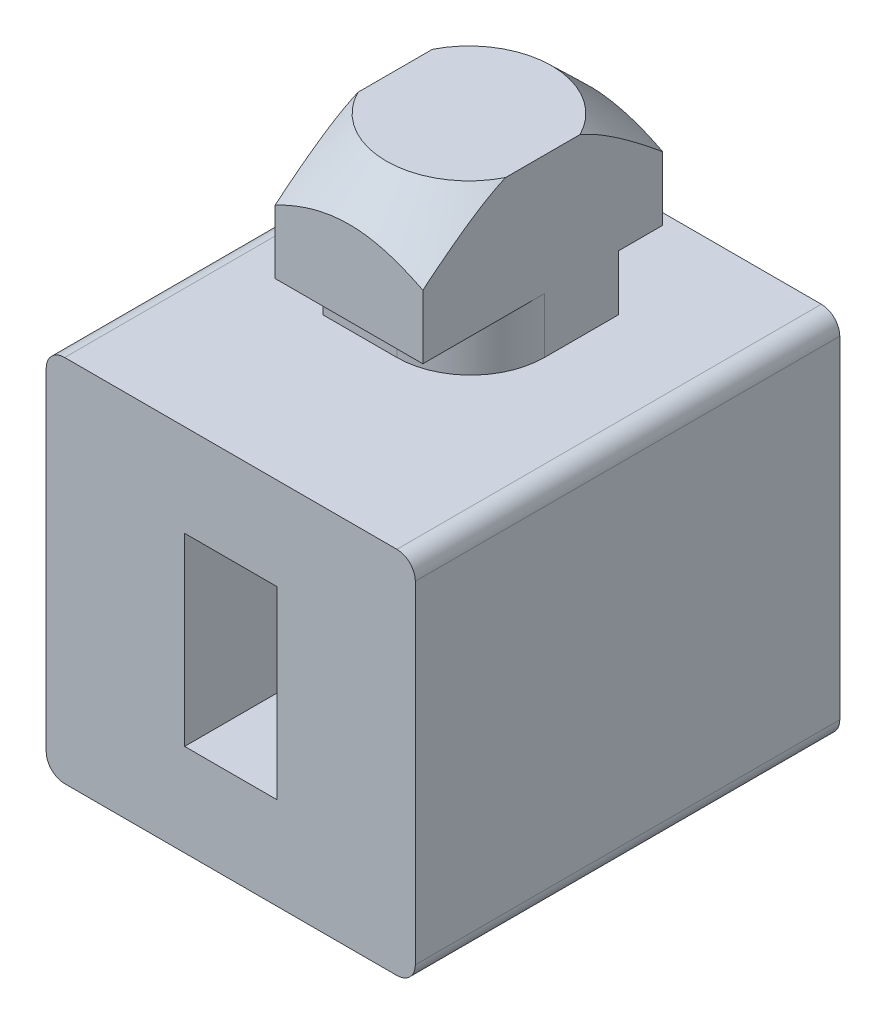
SolidWorks part; units mm, degrees
ref_plane "前视基准面" through (0, 0, 0) normal (0, 0, 1) x (1, 0, 0)
ref_plane "上视基准面" through (0, 0, 0) normal (0, 1, 0) x (1, 0, 0)
ref_plane "右视基准面" through (0, 0, 0) normal (1, 0, 0) x (0, 0, -1)
sketch "草图1" plane through (0, 0, 0) normal (0, 0, 1) x (1, 0, 0)
  line L1 (-10, 10) -> (10, 10)
  line L2 (-10, 10) -> (-10, -10)
  line L3 (-10, -10) -> (10, -10)
  line L4 (10, 10) -> (10, -10)
  line L5 (-10, 10) -> (10, -10) construction
  line L6 (-10, -10) -> (10, 10) construction
  point P0 (0, 0)
  dimension "D1" = 20
  dimension "D2" = 20
extrude "凸台-拉伸1" add sketch "草图1" along normal mid plane 23
sketch "草图2" plane through (0, 10, 0) normal (0, 1, 0) x (1, 0, 0)
  line L0 (0, 0) -> (0, 16.8869) construction
  line L2 (0, 5.5) -> (4, 5.5)
  line L3 (-4, 1.5) -> (-4, -2.5)
  line L4 (-4, -2.5) -> (0, -2.5)
  line L5 (4, 5.5) -> (4, 1.5)
  line L6 (-4, 5.5) -> (4, -2.5) construction
  line L7 (-4, -2.5) -> (4, 5.5) construction
  arc A0 (0, 5.5) -> (-4, 1.5) centre (0, 1.5) ccw
  arc A1 (0, -2.5) -> (4, 1.5) centre (0, 1.5) ccw
  point P3 (0, 1.5)
  dimension "D1" = 8
  dimension "D2" = 8
  dimension "D3" = 6
extrude "凸台-拉伸2" add sketch "草图2" along normal blind 3
sketch "草图3" plane through (0, 13, 0) normal (0, 1, 0) x (1, 0, 0)
  line L0 (0, 10.0852) -> (0, -7.2707) construction
  line L1 (-4, 1.5) -> (6.1762, 1.5) construction
  line L3 (-4, 7.9072) -> (4, 7.9072)
  line L4 (-4, 7.9072) -> (-4, -5.0928)
  line L5 (-4, -5.0928) -> (4, -5.0928)
  line L6 (4, 7.9072) -> (4, -5.0928)
  line L7 (-4, 7.9072) -> (4, -5.0928) construction
  line L8 (-4, -5.0928) -> (4, 7.9072) construction
  point P6 (0, 1.4072)
  dimension "D1" = 8
  dimension "D2" = 13
extrude "凸台-拉伸3" add sketch "草图3" along normal blind 6.5
sketch "草图5" plane through (0, 0, -11.5) normal (0, 0, -1) x (-1, 0, 0)
  line L1 (-2.5, 5) -> (2.5, 5)
  line L2 (-2.5, 5) -> (-2.5, -5)
  line L3 (-2.5, -5) -> (2.5, -5)
  line L4 (2.5, 5) -> (2.5, -5)
  line L5 (-2.5, 5) -> (2.5, -5) construction
  line L6 (-2.5, -5) -> (2.5, 5) construction
  point P0 (0, 0)
  dimension "D1" = 5
  dimension "D2" = 10
extrude "切除-拉伸1" cut sketch "草图5" against normal blind 25
sketch "草图6" plane through (0, -10, 0) normal (0, -1, 0) x (1, 0, 0)
  line L0 (0, 0) -> (0, -17.1683) construction
  line L2 (-5, 1) -> (5, 1)
  line L3 (-5, 1) -> (-5, -4)
  line L4 (-5, -4) -> (5, -4)
  line L5 (5, 1) -> (5, -4)
  line L6 (-5, 1) -> (5, -4) construction
  line L7 (-5, -4) -> (5, 1) construction
  point P3 (0, -1.5)
  dimension "D1" = 5
  dimension "D2" = 10
  dimension "D3" = 7.5
extrude "切除-拉伸2" cut sketch "草图6" against normal blind 15
sketch "草图7" plane through (0, 19.5, 0) normal (0, 1, 0) x (1, 0, 0)
  arc A0 (6.2991, 3.0107) -> (6.4649, 0.7326) centre (0, 1.4072) ccw
ref_plane "基准面2" through (6.2991, 19.5, -3.0107) normal (-0.2467, 0, -0.9691) x (-0.9691, 0, 0.2467)
sketch "草图8" plane through (6.2991, 19.5, -3.0107) normal (-0.2467, 0, -0.9691) x (-0.9691, 0, 0.2467)
  line L0 (2.0202, 0) -> (-1.1829, 3.2031)
  line L3 (13, 0) -> (0, 0) construction
  line L4 (-1.1829, 3.2031) -> (-1.1829, -3.0932)
  line L5 (-1.1829, -3.0932) -> (2.0202, 0)
  dimension "D1" = 1
  dimension "D2" = 45
  dimension "D3" = 44
sweep "切除-扫描1" cut profiles "草图8" path "草图7"
fillet "圆角1" radius 1 4 edges at (-10, -10, 0) (-10, 10, 0) (10, -10, 0) (10, 10, 0)
